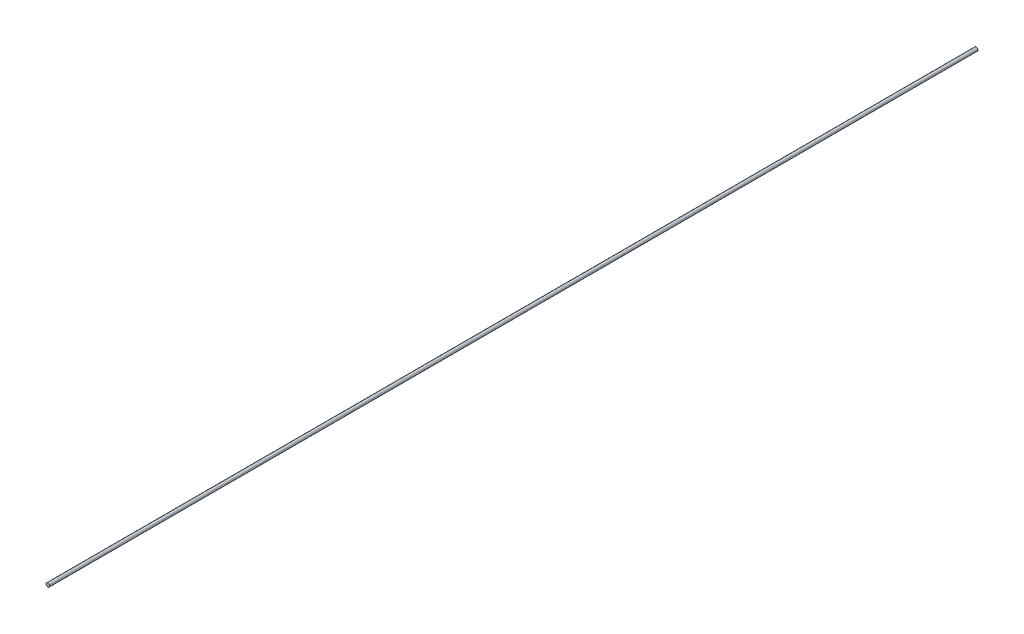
SolidWorks part; units mm, degrees
ref_plane "Front Plane" through (0, 0, 0) normal (0, 0, 1) x (1, 0, 0)
ref_plane "Top Plane" through (0, 0, 0) normal (0, 1, 0) x (1, 0, 0)
ref_plane "Right Plane" through (0, 0, 0) normal (1, 0, 0) x (0, 0, -1)
sketch "Sketch1" plane through (0, 0, 0) normal (1, 0, 0) x (0, 0, -1)
  line L0 (0, 0) -> (-2605.55, 0)
  dimension "D1" = 2605.55
sketch "Sketch2" plane through (0, 0, 0) normal (0, 0, 1) x (1, 0, 0)
  circle A0 centre (0, 0) radius 5
  dimension "D1" = 10
sweep "Sweep1" add profiles "Sketch2" path "Sketch1"
